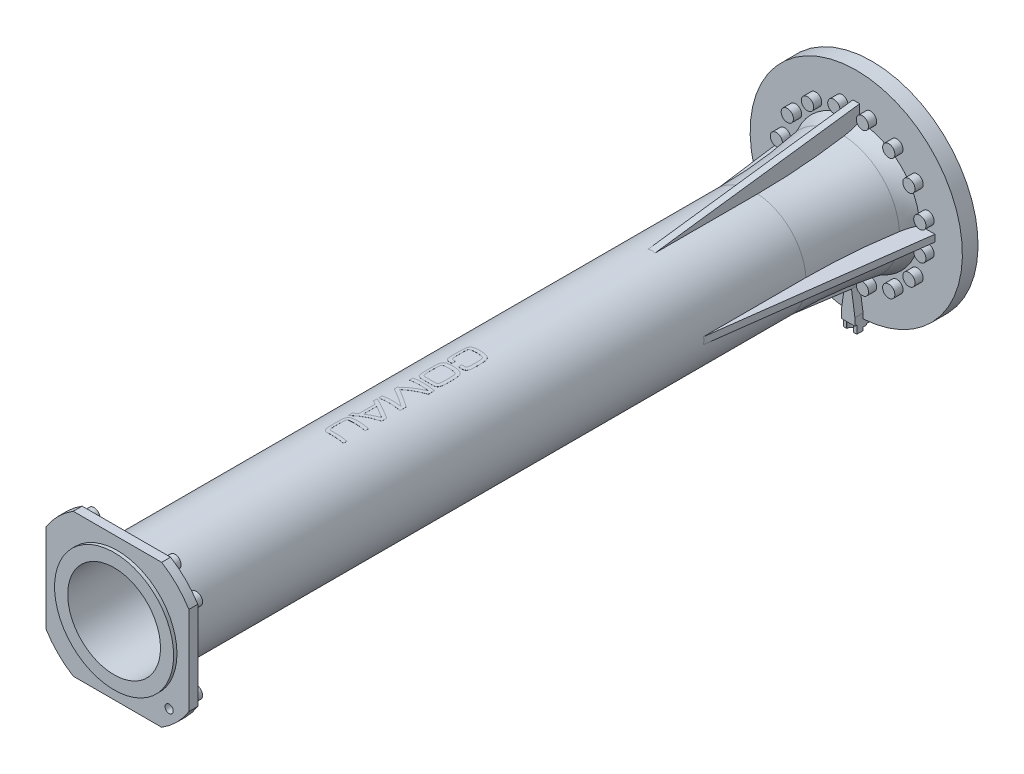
SolidWorks part; units mm, degrees
ref_plane "Piano1 (Front/Back)" through (0, 0, 0) normal (0, 0, 1) x (1, 0, 0)
ref_plane "Piano2 (Top/Bottom)" through (0, 0, 0) normal (0, 1, 0) x (1, 0, 0)
ref_plane "Piano3 (Left/Right)" through (0, 0, 0) normal (1, 0, 0) x (0, 0, -1)
imported_body "Importato1"
sketch "Schizzo2" plane through (0, 0, 0) normal (0, 1, 0) x (1, 0, 0)
  line L0 (-15, -795) -> (-15, -575) construction
  line L2 (0, 0) -> (0, -1168.0659) construction
  line L3 (156, 0) -> (-156, 0) construction
  text T0 "<b>COMAU</b>" font "MicrogrammaDMedExt" height 31.5
  dimension "D1" = 795
  dimension "D2" = 15
  dimension "D3" = 220
extrude "Estrusione2" add sketch "Schizzo2" against normal offset from surface (75.5969 mm away) 0.1
sketch "Schizzo3" plane through (0, 0, 0) normal (0, 1, 0) x (1, 0, 0)
  line L0 (-15, -575) -> (-15, -816.9115) construction
  line L1 (-15, -705.2466) -> (-15, -710.4247) construction
  line L3 (156, 0) -> (-156, 0) construction
  text T0 "COMAU" font "MicrogrammaDMedExt" height 31.5
  dimension "D1" = 575
extrude "Estrusione3" add sketch "Schizzo3" along normal offset from surface (75.5969 mm away) 0.1
sketch "Schizzo4" plane through (0, 0, 1113.92) normal (0, 0, 1) x (1, 0, 0)
  circle A0 centre (0, 0) radius 68.2 construction
  circle A1 centre (0, 0) radius 68.2
extrude "Taglio-Estrusione1" cut sketch "Schizzo4" against normal through all
